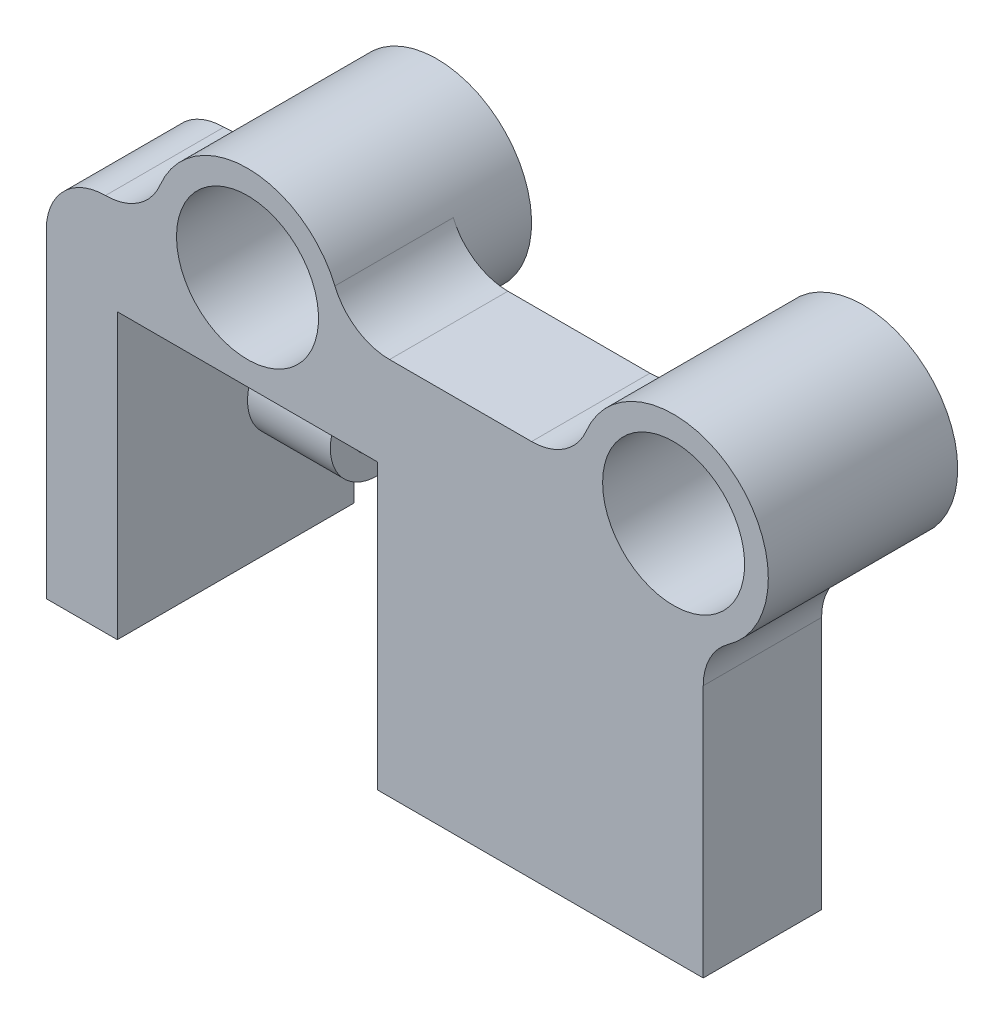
SolidWorks part; units mm, degrees
ref_plane "Plan de face" through (0, 0, 0) normal (0, 0, 1) x (1, 0, 0)
ref_plane "Plan de dessus" through (0, 0, 0) normal (0, 1, 0) x (1, 0, 0)
ref_plane "Plan de droite" through (0, 0, 0) normal (1, 0, 0) x (0, 0, -1)
sketch "Esquisse1" plane through (0, 0, 0) normal (0, 0, 1) x (1, 0, 0)
  line L0 (28, 0) -> (61, 0)
  line L1 (0, 0) -> (6, 0)
  line L2 (0, 0) -> (0, 32)
  line L3 (8, 40) -> (53, 40)
  line L4 (61, 0) -> (61, 32)
  line L6 (6, 0) -> (6, 24)
  line L7 (6, 24) -> (28, 24)
  line L8 (28, 0) -> (28, 24)
  arc A0 (53, 40) -> (61, 32) centre (53, 32) cw
  arc A1 (0, 32) -> (8, 40) centre (8, 32) cw
  dimension "D6" = 8
  dimension "D1" = 61
  dimension "D2" = 40
  dimension "D3" = 6
  dimension "D4" = 24
  dimension "D5" = 22
extrude "Boss.-Extru.1" add sketch "Esquisse1" along normal blind 5
sketch "Esquisse2" plane through (0, 0, 0) normal (0, 0, -1) x (-1, 0, 0)
  line L1 (-28, 0) -> (-61, 0) construction
  line L3 (0, 32) -> (0, 0) construction
  circle A0 centre (-53, 32) radius 8
  circle A1 centre (-17, 32) radius 8
  dimension "D1" = 16
  dimension "D4" = 16
  dimension "D2" = 17
  dimension "D3" = 32
  dimension "D5" = 32
  dimension "D6" = 36
extrude "Boss.-Extru.2" add sketch "Esquisse2" along normal blind 11
sketch "Esquisse3" plane through (0, 0, -11) normal (0, 0, -1) x (-1, 0, 0)
  circle A0 centre (-53, 32) radius 6
  circle A1 centre (-17, 32) radius 6
  dimension "D1" = 12
  dimension "D2" = 12
extrude "Enlèv. mat.-Extru.1" cut sketch "Esquisse3" against normal up to next
sketch "Esquisse4" plane through (0, 0, 0) normal (0, 0, -1) x (-1, 0, 0)
  line L0 (-45, 32) -> (-25, 32)
  line L1 (-46.755, 27) -> (-23.245, 27)
  line L2 (-55.5, 0) -> (-55.5, 24.4007)
  line L3 (-28, 0) -> (-61, 0) construction
  line L4 (-50.5, 0) -> (-50.5, 24.4007)
  line L5 (-10.755, 27) -> (0, 27)
  line L6 (0, 32) -> (0, 0) construction
  line L7 (-9, 32) -> (0, 32)
  line L8 (-50.5, 0) -> (-55.5, 0)
  line L9 (0, 32) -> (0, 27)
  arc A0 (-61, 32) -> (-53, 40) centre (-53, 32) ccw construction
  circle A1 centre (-53, 32) radius 8 construction
  arc A2 (-17, 40) -> (-17, 24) centre (-17, 32) ccw construction
  circle A3 centre (-17, 32) radius 8 construction
  arc A4 (-55.5, 24.4007) -> (-50.5, 24.4007) centre (-53, 32) ccw
  arc A5 (-46.755, 27) -> (-45, 32) centre (-53, 32) ccw
  arc A6 (-10.755, 27) -> (-9, 32) centre (-17, 32) ccw
  arc A7 (-25, 32) -> (-23.245, 27) centre (-17, 32) ccw
  dimension "D1" = 5
  dimension "D2" = 5
  dimension "D3" = 2.5
extrude "Boss.-Extru.3" add sketch "Esquisse4" along normal blind 5
sketch "Esquisse6" plane through (0, 0, 0) normal (0, 0, -1) x (-1, 0, 0)
  line L2 (-45, 32) -> (-25, 32)
  line L3 (-17, 40) -> (-53, 40)
  line L4 (-45, 32) -> (-25, 32)
  line L5 (-17, 40) -> (-53, 40)
  arc A2 (-45, 32) -> (-53, 40) centre (-53, 32) ccw
  arc A3 (-17, 40) -> (-25, 32) centre (-17, 32) ccw
  arc A4 (-45, 32) -> (-53, 40) centre (-53, 32) ccw
  arc A5 (-17, 40) -> (-25, 32) centre (-17, 32) ccw
  dimension "D1" = 0
extrude "Enlèv. mat.-Extru.4" cut sketch "Esquisse6" against normal up to next
sketch "Esquisse7" plane through (0, 0, 0) normal (0, 0, -1) x (-1, 0, 0)
  line L3 (-61, 0) -> (-55.5, 0)
  line L4 (-55.5, 0) -> (-55.5, 24.4007)
  line L5 (-61, 32) -> (-61, 0)
  line L6 (-61, 0) -> (-55.5, 0)
  line L7 (-55.5, 0) -> (-55.5, 24.4007)
  line L8 (-61, 32) -> (-61, 0)
  arc A1 (-61, 32) -> (-55.5, 24.4007) centre (-53, 32) ccw
  arc A2 (-61, 32) -> (-55.5, 24.4007) centre (-53, 32) ccw
  dimension "D1" = 0
extrude "Enlèv. mat.-Extru.5" cut sketch "Esquisse7" against normal up to next
sketch "Esquisse8" plane through (0, 0, 0) normal (0, 0, -1) x (-1, 0, 0)
  line L2 (-9, 32) -> (0, 32)
  line L3 (-8, 40) -> (-17, 40)
  line L4 (-9, 32) -> (0, 32)
  line L5 (-8, 40) -> (-17, 40)
  arc A2 (-9, 32) -> (-17, 40) centre (-17, 32) ccw
  arc A3 (0, 32) -> (-8, 40) centre (-8, 32) ccw
  arc A4 (-9, 32) -> (-17, 40) centre (-17, 32) ccw
  arc A5 (0, 32) -> (-8, 40) centre (-8, 32) ccw
  dimension "D1" = 0
extrude "Enlèv. mat.-Extru.6" cut sketch "Esquisse8" against normal up to next
sketch "Esquisse9" plane through (0, 0, 0) normal (-1, 0, 0) x (0, 0, 1)
  line L0 (0, 0) -> (-15, 0)
  line L1 (-5, 27) -> (-11, 23.5359)
  line L2 (-15, 16.6077) -> (-15, 0)
  line L3 (0, 27) -> (0, 0) construction
  line L5 (0, 0) -> (0, 24.4007) construction
  line L6 (-5, 27) -> (0, 27) construction
  line L8 (0, 0) -> (0, 27)
  line L9 (-5, 27) -> (0, 27)
  arc A0 (-11, 23.5359) -> (-15, 16.6077) centre (-7, 16.6077) ccw
  dimension "D3" = 8
  dimension "D1" = 15
  dimension "D2" = 120
extrude "Boss.-Extru.4" add sketch "Esquisse9" against normal blind 6
pattern_linear "Répétition linéaire1" count 2 spacing 28 along (1, 0, 0) of "Boss.-Extru.4"
sketch "Esquisse10" plane through (6, 0, 0) normal (1, 0, 0) x (0, 0, -1)
  line L0 (-5, 0) -> (15, 0) construction
  line L1 (-5, 0) -> (-5, 24) construction
  circle A0 centre (10, 12) radius 4
  dimension "D1" = 8
  dimension "D2" = 12
  dimension "D3" = 15
extrude "Boss.-Extru.5" add sketch "Esquisse10" along normal blind 7
pattern_linear "Répétition linéaire2" count 2 spacing 15 along (1, 0, 0) of "Boss.-Extru.5"
sketch "Esquisse11" plane through (0, 0, 0) normal (-1, 0, 0) x (0, 0, 1)
  circle A0 centre (-10, 12) radius 4
  dimension "D1" = 8
extrude "Enlèv. mat.-Extru.7" cut sketch "Esquisse11" against normal blind 4
sketch "Esquisse12" plane through (34, 0, 0) normal (1, 0, 0) x (0, 0, -1)
  line L1 (14, 9.6906) -> (14, 14.3094)
  line L2 (14, 14.3094) -> (10, 16.6188)
  line L3 (10, 16.6188) -> (6, 14.3094)
  line L4 (6, 14.3094) -> (6, 9.6906)
  line L5 (6, 9.6906) -> (10, 7.3812)
  line L6 (10, 7.3812) -> (14, 9.6906)
  circle A0 centre (10, 12) radius 4 construction
  dimension "D1" = 8
extrude "Enlèv. mat.-Extru.8" cut sketch "Esquisse12" against normal blind 4
sketch "Esquisse13" plane through (4, 0, 0) normal (-1, 0, 0) x (0, 0, 1)
  circle A0 centre (-10, 12) radius 2.15
  dimension "D1" = 4.3
extrude "Enlèv. mat.-Extru.9" cut sketch "Esquisse13" against normal up to surface (26 mm away)
fillet "Congé1" radius 5 9 edges at (10.755, 27, -2.5) (23.245, 27, -2.5) (50.5, 24.4007, -2.5) (55.5, 24.4007, 0) (0, 32, 0) (25, 32, 0) (45, 32, 0) (9, 32, 0) (46.755, 27, -2.5)
